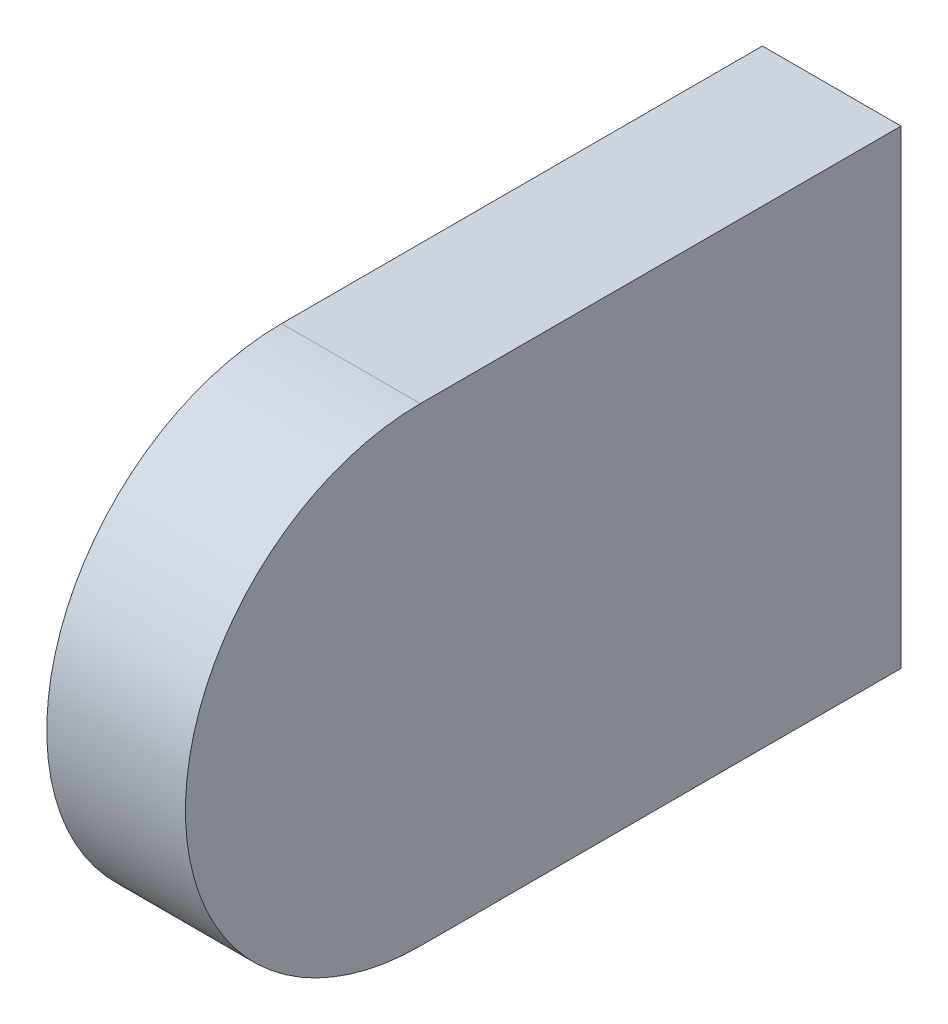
SolidWorks part; units mm, degrees
ref_plane "Front Plane" through (0, 0, 0) normal (1, 0, 0) x (0, 1, 0)
ref_plane "Top Plane" through (0, 0, 0) normal (0, 0, 1) x (0, 1, 0)
ref_plane "Right Plane" through (0, 0, 0) normal (0, 1, 0) x (-1, 0, 0)
sketch "Sketch1" plane through (0, 0, 0) normal (1, 0, 0) x (0, 1, 0)
  line L0 (0, 0) -> (0, -260) construction
  line L3 (-127, 0) -> (-127, -260)
  line L4 (-127, -260) -> (127, -260)
  line L5 (127, 0) -> (127, -260)
  arc A2 (127, 0) -> (-127, 0) centre (0, 0) ccw
  dimension "D1" = 260
  dimension "D2" = 260
  dimension "D3" = 127
extrude "Boss-Extrude1" add sketch "Sketch1" along normal blind 75 contours A2 L3 L4 L5
